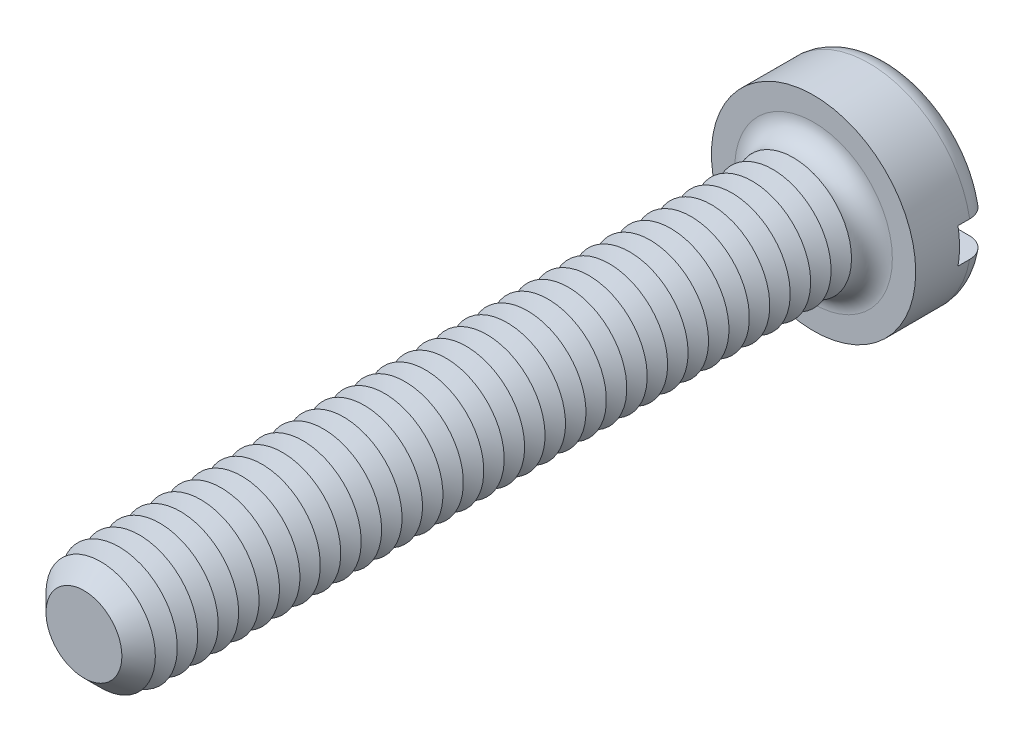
SolidWorks part; units mm, degrees
ref_plane "Front Plane" through (0, 0, 0) normal (0, 0, 1) x (1, 0, 0)
ref_plane "Top Plane" through (0, 0, 0) normal (0, 1, 0) x (1, 0, 0)
ref_plane "Right Plane" through (0, 0, 0) normal (1, 0, 0) x (0, 0, -1)
sketch "Sketch3" plane through (0, 0, 0) normal (0, 0, 1) x (1, 0, 0)
  circle A0 centre (0, 0) radius 3.5
  dimension "D1" = 7
extrude "Boss-Extrude2" add sketch "Sketch3" against normal blind 2.6
sketch "Sketch4" plane through (0, 0, 0) normal (0, 0, 1) x (1, 0, 0)
  circle A0 centre (0, 0) radius 2
  dimension "D1" = 4
extrude "Boss-Extrude3" add sketch "Sketch4" along normal blind 25
fillet "Fillet1" radius 0.7 2 edges at (3.5, 0, -2.6) (2, 0, 0)
chamfer "Chamfer1" distance 0.7 angle 45 1 edges at (2, 0, 25)
sketch "Sketch5" plane through (0, 0, 0) normal (1, 0, 0) x (0, 0, -1)
  line L0 (1.6944, 0) -> (-7.6738, 0) construction
sketch "Sketch6" plane through (0, 0, 0) normal (1, 0, 0) x (0, 0, -1)
  line L0 (-0.7, 2) -> (-1.05, 1.3938)
  line L1 (-1.05, 1.3938) -> (-1.4, 2)
  line L2 (-0.7, 2) -> (-24.3, 2) construction
  line L3 (-1.4, 2) -> (-0.7, 2)
  dimension "D1" = 0.7
revolve "Cut-Revolve1" cut sketch "Sketch6" angle 360 about L0
pattern_linear "LPattern1" count 34 spacing 0.7 along (0, 0, 1) of "Cut-Revolve1"
sketch "Sketch8" plane through (0, 0, -2.6) normal (0, 0, -1) x (-1, 0, 0)
  line L1 (3.5, -0.6) -> (-3.5, -0.6)
  line L2 (3.5, -0.6) -> (3.5, 0.6)
  line L3 (3.5, 0.6) -> (-3.5, 0.6)
  line L4 (-3.5, -0.6) -> (-3.5, 0.6)
  line L5 (3.5, -0.6) -> (-3.5, 0.6) construction
  line L6 (3.5, 0.6) -> (-3.5, -0.6) construction
  point P0 (0, 0)
  dimension "D1" = 7
  dimension "D2" = 1.2
extrude "Cut-Extrude1" cut sketch "Sketch8" against normal blind 1.1
